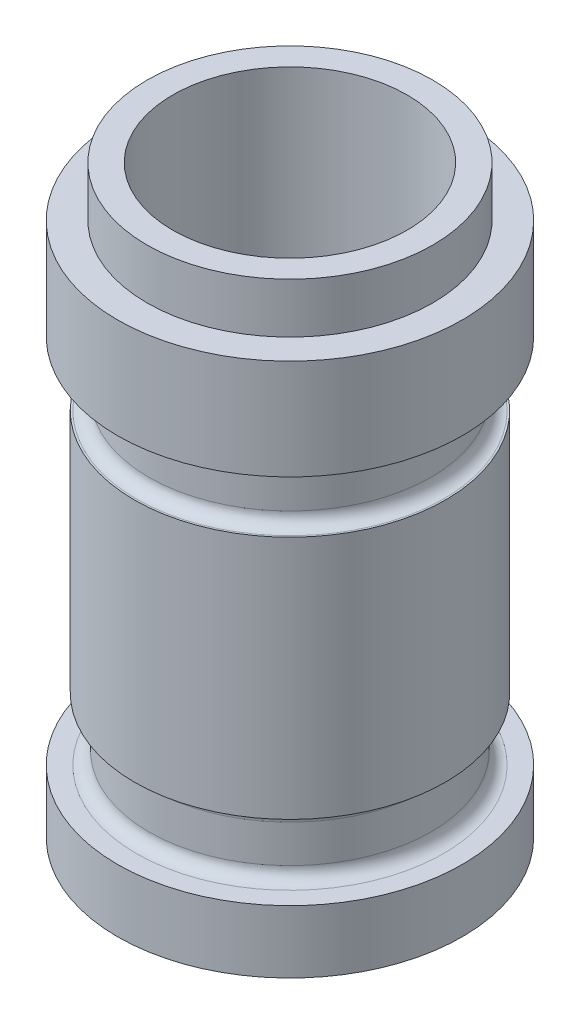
SolidWorks part; units mm, degrees
ref_plane "Front Plane" through (0, 0, 0) normal (0, 0, 1) x (1, 0, 0)
ref_plane "Top Plane" through (0, 0, 0) normal (0, 1, 0) x (1, 0, 0)
ref_plane "Right Plane" through (0, 0, 0) normal (1, 0, 0) x (0, 0, -1)
sketch "Sketch1" plane through (0, 0, 0) normal (0, 0, 1) x (1, 0, 0)
  line L0 (0, 236.22) -> (0, 0) construction
  line L1 (0, 0) -> (0, 0.5)
  line L2 (0, 0) -> (2.75, 0)
  line L3 (2.75, 0) -> (2.75, 1)
  line L4 (2.75, 1) -> (2.45, 1)
  line L5 (0, 0.5) -> (1.37, 0.9879)
  line L6 (1.37, 0.9879) -> (1.87, 0.9879)
  line L7 (1.87, 0.9879) -> (1.87, 9.324)
  line L8 (2.25, 1.2) -> (2.25, 1.8)
  line L9 (2.45, 2) -> (2.479, 2)
  line L10 (2.479, 2) -> (2.479, 5.9)
  line L11 (2.479, 5.9) -> (2.45, 5.9)
  line L12 (2.25, 6.1) -> (2.25, 6.724)
  line L13 (2.45, 6.924) -> (2.75, 6.924)
  line L14 (2.75, 6.924) -> (2.75, 8.524)
  line L15 (2.75, 8.524) -> (2.28, 8.524)
  line L16 (2.28, 8.524) -> (2.28, 9.324)
  line L17 (2.28, 9.324) -> (1.87, 9.324)
  arc A0 (2.45, 1) -> (2.25, 1.2) centre (2.45, 1.2) cw
  arc A1 (2.45, 2) -> (2.25, 1.8) centre (2.45, 1.8) ccw
  arc A2 (2.45, 5.9) -> (2.25, 6.1) centre (2.45, 6.1) cw
  arc A3 (2.25, 6.724) -> (2.45, 6.924) centre (2.45, 6.724) cw
  point P13 (2.25, 1)
  point P17 (2.25, 2)
  dimension "D7" = 1
  dimension "D9" = 0.2
  dimension "D12" = 0.2
  dimension "D14" = 1.6
  dimension "D8" = 0.2
  dimension "D1" = 0.5
  dimension "D2" = 2.75
  dimension "D3" = 1
  dimension "D4" = 0.3
  dimension "D5" = 9.324
  dimension "D6" = 0.5
  dimension "D10" = 0.029
  dimension "D11" = 3.9
  dimension "D15" = 0.47
  dimension "D16" = 0.41
  dimension "D17" = 0.8
  dimension "D18" = 160.399
revolve "Revolve1" add sketch "Sketch1" angle 360 about L0
